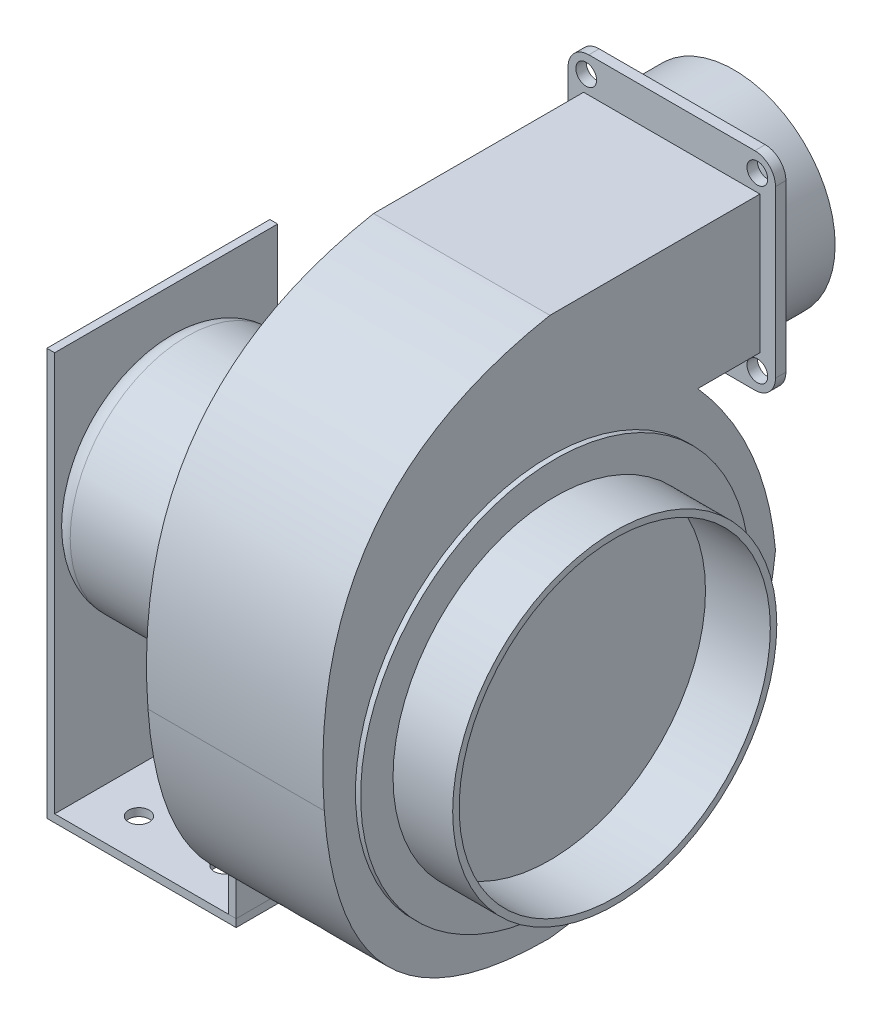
SolidWorks part; units mm, degrees
ref_plane "前视基准面" through (0, 0, 0) normal (0, 0, 1) x (1, 0, 0)
ref_plane "上视基准面" through (0, 0, 0) normal (0, 1, 0) x (1, 0, 0)
ref_plane "右视基准面" through (0, 0, 0) normal (1, 0, 0) x (0, 0, -1)
sketch "草图1" plane through (0, 0, 0) normal (1, 0, 0) x (0, 0, -1)
  line L0 (0, 122) -> (81, 122)
  line L1 (57, 69) -> (81, 69)
  line L2 (81, 122) -> (81, 69)
  spline S0 degree 2 poles (57, 69) (83.3975, 39.1492) (87, 0) knots 0 0 0 1 1 1
  spline S1 degree 2 poles (87, 0) (78.2158, -76.7497) (0, -86) knots 0 0 0 1 1 1
  spline S2 degree 2 poles (-87, 0) (-80.7209, -86.261) (0, -86) knots 0 0 0 1 1 1
  spline S3 degree 2 poles (-87, 0) (-94.6156, 104.3773) (0, 122) knots 0 0 0 1 1 1
extrude "凸台-拉伸1" add sketch "草图1" along normal blind 68
sketch "草图2" plane through (0, 0, -81) normal (0, 0, -1) x (-1, 0, 0)
  line L4 (-66, 55.5) -> (-2, 55.5)
  line L5 (-74, 63.5) -> (-74, 127.5)
  line L6 (-66, 135.5) -> (-2, 135.5)
  line L7 (6, 63.5) -> (6, 127.5)
  line L8 (-74, 55.5) -> (6, 135.5) construction
  line L9 (-74, 135.5) -> (6, 55.5) construction
  arc A0 (-2, 135.5) -> (6, 127.5) centre (-2, 127.5) cw
  arc A1 (-2, 55.5) -> (6, 63.5) centre (-2, 63.5) ccw
  arc A2 (-66, 55.5) -> (-74, 63.5) centre (-66, 63.5) cw
  arc A3 (-74, 127.5) -> (-66, 135.5) centre (-66, 127.5) cw
  point P6 (-34, 95.5)
  dimension "D1" = 8
extrude "凸台-拉伸2" add sketch "草图2" along normal blind 4
sketch "草图3" plane through (0, 0, -85) normal (0, 0, -1) x (-1, 0, 0)
  circle A0 centre (-67, 128.5) radius 4
  circle A1 centre (-1, 128.5) radius 4
  circle A2 centre (-1, 62.5) radius 4
  circle A3 centre (-67, 62.5) radius 4
  point P6 (-34, 95.5)
extrude "切除-拉伸1" cut sketch "草图3" against normal blind 5
sketch "草图4" plane through (0, 0, -85) normal (0, 0, -1) x (-1, 0, 0)
  line L4 (-60, 69.5) -> (-8, 69.5)
  line L5 (-60, 69.5) -> (-60, 121.5)
  line L6 (-60, 121.5) -> (-8, 121.5)
  line L7 (-8, 69.5) -> (-8, 121.5)
  line L8 (-60, 69.5) -> (-8, 121.5) construction
  line L9 (-60, 121.5) -> (-8, 69.5) construction
  point P6 (-34, 95.5)
extrude "切除-拉伸2" cut sketch "草图4" against normal blind 80
sketch "草图6" plane through (0, 0, -85) normal (0, 0, -1) x (-1, 0, 0)
  circle A0 centre (-34, 95.5) radius 37
  circle A1 centre (-34, 95.5) radius 39
extrude "凸台-拉伸3" add sketch "草图6" along normal blind 20
sketch "草图7" plane through (68, 0, 0) normal (1, 0, 0) x (0, 0, -1)
  circle A0 centre (0, 0) radius 62.5
  circle A1 centre (0, 0) radius 60
extrude "凸台-拉伸4" add sketch "草图7" along normal blind 25
sketch "草图8" plane through (68, 0, 0) normal (1, 0, 0) x (0, 0, -1)
  circle A0 centre (0, 0) radius 75
  circle A1 centre (0, 0) radius 62.5
extrude "凸台-拉伸5" add sketch "草图8" along normal blind 2
sketch "草图9" plane through (0, 0, 0) normal (-1, 0, 0) x (0, 0, 1)
  circle A0 centre (0, 0) radius 45
extrude "凸台-拉伸6" add sketch "草图9" along normal blind 80
fillet "圆角1" radius 8 1 edges at (-80, 0, 45)
sketch "草图10" plane through (-80, 0, 0) normal (-1, 0, 0) x (0, 0, 1)
  line L0 (-43, -100) -> (43, -100)
  line L4 (-43, 57) -> (-43, -100)
  line L6 (43, -100) -> (43, 57)
  line L7 (43, 57) -> (-43, 57)
extrude "凸台-拉伸7" add sketch "草图10" along normal blind 3
sketch "草图11" plane through (-80, 0, 0) normal (1, 0, 0) x (0, 0, -1)
  line L0 (-43, -100) -> (43, -100)
  line L1 (43, -100) -> (43, -97)
  line L2 (43, 57) -> (43, -100) construction
  line L3 (43, -97) -> (-43, -97)
  line L4 (-43, -100) -> (-43, 57) construction
  line L5 (-43, -97) -> (-43, -100)
extrude "凸台-拉伸8" add sketch "草图11" along normal blind 70
sketch "草图12" plane through (0, -97, 0) normal (0, 1, 0) x (1, 0, 0)
  line L0 (-10, 43) -> (-10, -43)
  line L1 (-10, -43) -> (-13, -43)
  line L2 (-10, -43) -> (-80, -43) construction
  line L3 (-13, -43) -> (-13, 43)
  line L4 (-10, 43) -> (-80, 43) construction
  line L5 (-13, 43) -> (-10, 43)
extrude "凸台-拉伸10" add sketch "草图12" along normal blind 52 separate body
sketch "草图13" plane through (0, -100, 0) normal (0, -1, 0) x (1, 0, 0)
  circle A0 centre (-63, 27.5) radius 4
  circle A1 centre (-30, 27.5) radius 4
  circle A2 centre (-30, -27.5) radius 4
  circle A3 centre (-63, -27.5) radius 4
extrude "切除-拉伸3" cut sketch "草图13" against normal blind 3
